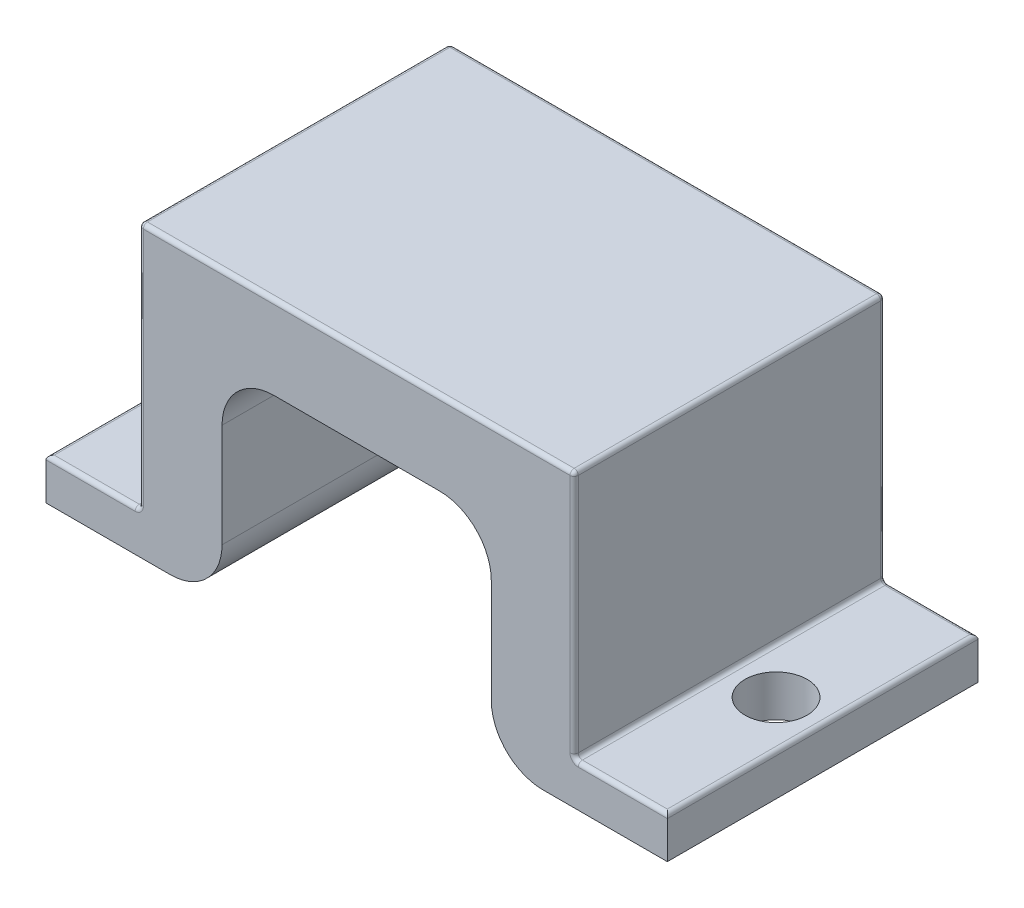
SolidWorks part; units mm, degrees
ref_plane "Alzado" through (0, 0, 0) normal (0, 0, 1) x (1, 0, 0)
ref_plane "Planta" through (0, 0, 0) normal (0, 1, 0) x (1, 0, 0)
ref_plane "Vista lateral" through (0, 0, 0) normal (1, 0, 0) x (0, 0, -1)
sketch "Croquis1" plane through (0, 0, 0) normal (0, 0, 1) x (1, 0, 0)
  line L0 (-10.4973, 0) -> (-1.9973, 0)
  line L1 (-1.9973, 0) -> (-1.9973, 10)
  line L2 (-1.9973, 10) -> (11.0027, 10)
  line L3 (11.0027, 10) -> (11.0027, 0)
  line L4 (11.0027, 0) -> (19.5027, 0)
  line L5 (19.5027, 0) -> (19.5027, 2)
  line L6 (19.5027, 2) -> (15.0027, 2)
  line L7 (15.0027, 2) -> (15.0027, 14)
  line L8 (15.0027, 14) -> (-5.9973, 14)
  line L9 (-5.9973, 14) -> (-5.9973, 2)
  line L10 (-5.9973, 2) -> (-10.4973, 2)
  line L11 (-10.4973, 2) -> (-10.4973, 0)
  point P12 (0, 0)
  point P14 (0, 0)
  point P15 (0, 0)
  dimension "D1" = 30
  dimension "D2" = 13
  dimension "D3" = 8.5
  dimension "D4" = 10
  dimension "D5" = 14
  dimension "D6" = 2
  dimension "D7" = 2
  dimension "D8" = 4.5
  dimension "D9" = 4.5
extrude "Saliente-Extruir1" add sketch "Croquis1" along normal blind 15
fillet "Redondeo1" radius 0.2 16 edges at (19.5027, 2, 7.5) (17.2527, 2, 15) (17.2527, 2, 0) (15.0027, 2, 7.5) (15.0027, 8, 15) (15.0027, 8, 0) (15.0027, 14, 7.5) (4.5027, 14, 15) (4.5027, 14, 0) (-5.9973, 14, 7.5) (-5.9973, 8, 15) (-5.9973, 8, 0) (-5.9973, 2, 7.5) (-8.2473, 2, 15) (-10.4973, 2, 7.5) (-8.2473, 2, 0)
sketch "Croquis2" plane through (0, 2, 0) normal (0, 1, 0) x (1, 0, 0)
  line L1 (-10.4973, 0) -> (-6.1973, 0) construction
  line L2 (15.2027, 0) -> (19.5027, 0) construction
  line L3 (-10.4973, -15) -> (-10.4973, 0) construction
  line L4 (19.5027, 0) -> (19.5027, -15) construction
  circle A0 centre (17.2527, -7.5) radius 1.5
  circle A1 centre (-8.2473, -7.5) radius 1.5
  dimension "D1" = 3
  dimension "D2" = 3
  dimension "D3" = 7.5
  dimension "D4" = 7.5
  dimension "D5" = 2.25
  dimension "D6" = 2.25
extrude "Cortar-Extruir1" cut sketch "Croquis2" against normal blind 15
fillet "Redondeo2" radius 2.5 4 edges at (11.0027, 0, 7.5) (11.0027, 10, 7.5) (-1.9973, 0, 7.5) (-1.9973, 10, 7.5)
